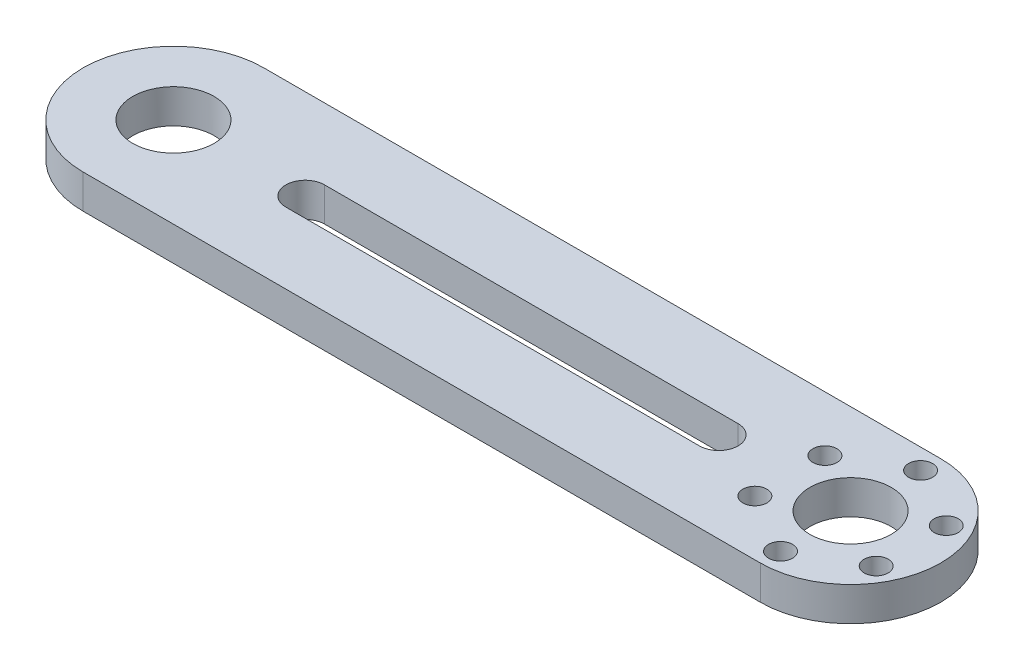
SolidWorks part; units mm, degrees
ref_plane "Front Plane" through (0, 0, 0) normal (0, 0, 1) x (1, 0, 0)
ref_plane "Top Plane" through (0, 0, 0) normal (0, 1, 0) x (1, 0, 0)
ref_plane "Right Plane" through (0, 0, 0) normal (1, 0, 0) x (0, 0, -1)
sketch "Sketch1" plane through (0, 0, 0) normal (0, 1, 0) x (1, 0, 0)
  line L0 (31.15, 0) -> (-31.15, 0) construction
  line L1 (31.15, -2.91) -> (-31.15, -2.91)
  line L2 (31.15, 2.91) -> (-31.15, 2.91)
  line L3 (51, 0) -> (-51, 0) construction
  line L4 (51, -13.6) -> (-51, -13.6)
  line L5 (51, 13.6) -> (-51, 13.6)
  arc A0 (31.15, -2.91) -> (31.15, 2.91) centre (31.15, 0) ccw
  arc A1 (-31.15, 2.91) -> (-31.15, -2.91) centre (-31.15, 0) ccw
  arc A2 (51, -13.6) -> (51, 13.6) centre (51, 0) ccw
  arc A3 (-51, 13.6) -> (-51, -13.6) centre (-51, 0) ccw
  point P2 (0, 0)
  point P10 (0, 0)
  dimension "D2" = 2.91
  dimension "D4" = 13.6
  dimension "D1" = 62.3
  dimension "D3" = 102
extrude "Boss-Extrude1" add sketch "Sketch1" along normal blind 5.12 contours L5 A3 L4 A2 | L2 A1 L1 A0
sketch "Sketch2" plane through (0, 5.12, 0) normal (0, 1, 0) x (1, 0, 0)
  line L0 (51, 0) -> (51, 10.55) construction
  line L1 (0, -2.816) -> (0, 2.816) construction
  circle A0 centre (51, 0) radius 6.13
  circle A2 centre (51, 10.55) radius 1.81
  circle A3 centre (60.1366, 5.275) radius 1.81
  circle A4 centre (60.1366, -5.275) radius 1.81
  circle A5 centre (51, -10.55) radius 1.81
  circle A6 centre (41.8634, -5.275) radius 1.81
  circle A7 centre (41.8634, 5.275) radius 1.81
  circle A8 centre (-51, 0) radius 6.13
  dimension "D1" = 12.26
  dimension "D2" = 3.62
  dimension "D5" = 10.55
  dimension "D4" = 6
extrude "Cut-Extrude1" cut sketch "Sketch2" against normal up to next
